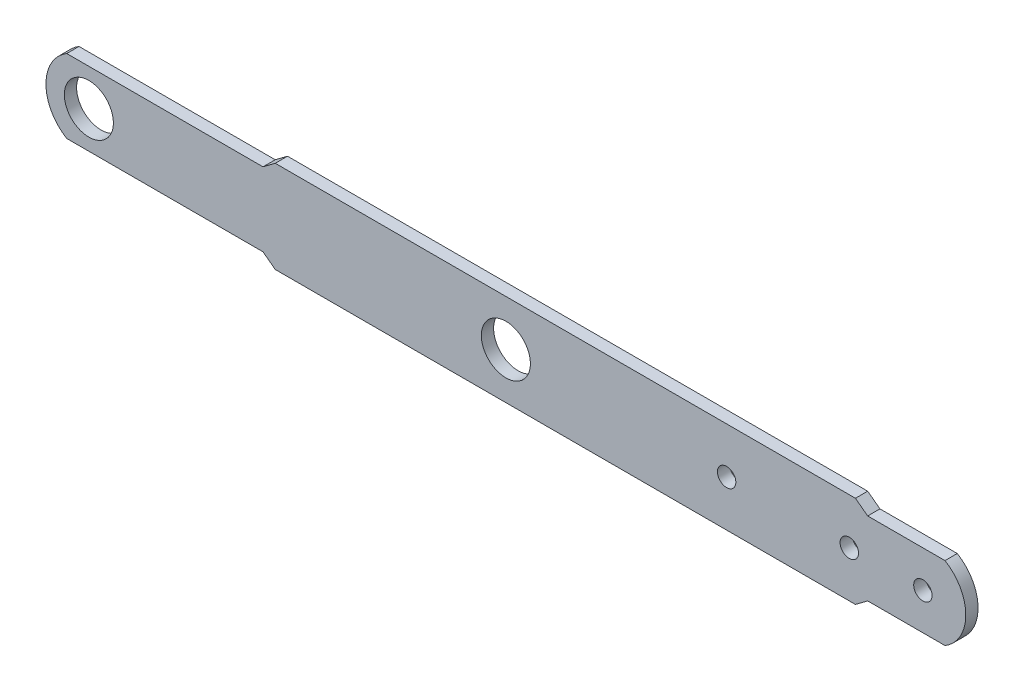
SolidWorks part; units mm, degrees
ref_plane "Face" through (0, 0, 0) normal (0, 0, 1) x (1, 0, 0)
ref_plane "Dessus" through (0, 0, 0) normal (0, 1, 0) x (1, 0, 0)
ref_plane "Droite" through (0, 0, 0) normal (1, 0, 0) x (0, 0, -1)
sketch "Esquisse1" plane through (0, 0, 0) normal (0, 0, 1) x (1, 0, 0)
  line L0 (-119.2721, 0) -> (123.1785, 0) construction
  line L1 (71.6056, 6) -> (59, 6)
  line L2 (59, 6) -> (57, 7.5)
  line L3 (57, 7.5) -> (-37.6056, 7.5)
  line L4 (0, 0) -> (0, 31.7765) construction
  line L5 (-37.6056, -7.5) -> (-39.6056, -6)
  line L6 (-71.6056, 6) -> (-39.6056, 6)
  line L7 (-71.6056, -6) -> (-39.6056, -6)
  line L8 (57, -7.5) -> (-37.6056, -7.5)
  line L10 (59, -6) -> (57, -7.5)
  line L11 (71.6056, -6) -> (59, -6)
  line L12 (-37.6056, 7.5) -> (-39.6056, 6)
  circle A0 centre (68, 0) radius 1.5
  arc A1 (71.6056, -6) -> (71.6056, 6) centre (68, 0) ccw
  arc A2 (-71.6056, -6) -> (-71.6056, 6) centre (-68, 0) cw
  circle A3 centre (-68, 0) radius 4
  circle A4 centre (0, 0) radius 4
  circle A5 centre (56, 0) radius 1.5
  circle A6 centre (36, 0) radius 1.5
  point P16 (0, 7.5)
  point P22 (0, -7.5)
  dimension "D2" = 14
  dimension "D8" = 8
  dimension "D11" = 3
  dimension "D12" = 3
  dimension "D13" = 20
  dimension "D15" = 3
  dimension "D16" = 8
  dimension "D3" = 12
  dimension "D4" = 15
  dimension "D5" = 9
  dimension "D6" = 2
  dimension "D7" = 136
  dimension "D9" = 2
  dimension "D10" = 32
  dimension "D14" = 12
extrude "Extrusion1" add sketch "Esquisse1" along normal blind 2
